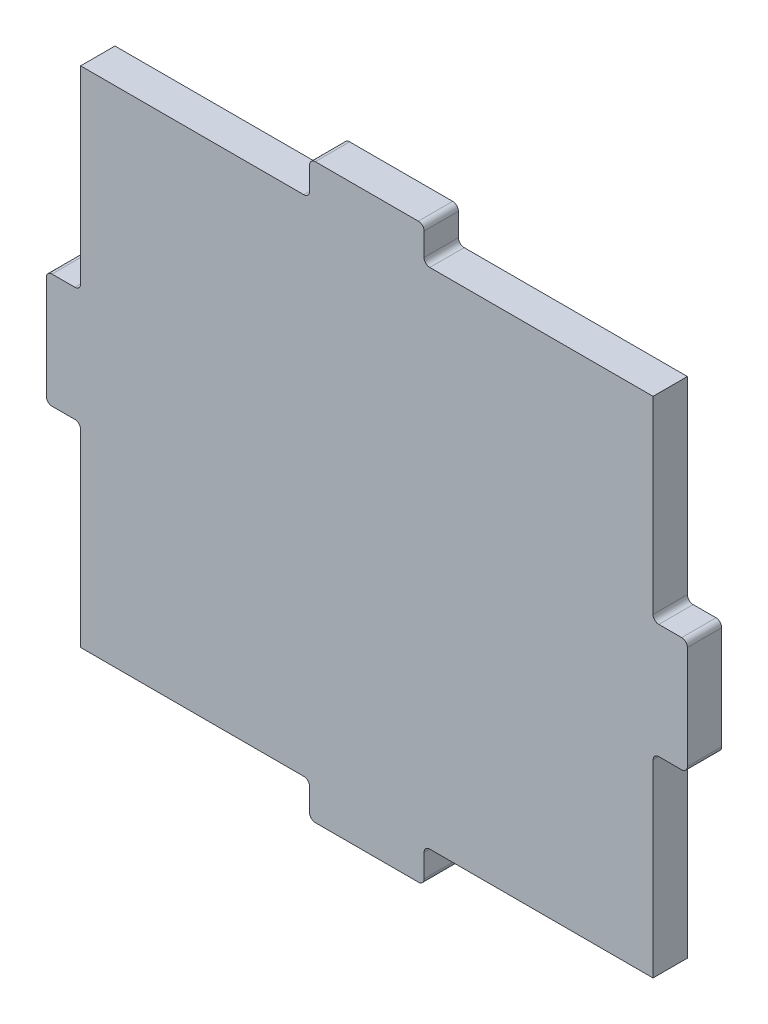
SolidWorks part; units mm, degrees
ref_plane "Front Plane" through (0, 0, 0) normal (0, 0, 1) x (1, 0, 0)
ref_plane "Top Plane" through (0, 0, 0) normal (0, 1, 0) x (1, 0, 0)
ref_plane "Right Plane" through (0, 0, 0) normal (1, 0, 0) x (0, 0, -1)
sketch "Sketch1" plane through (0, 0, 0) normal (0, 0, 1) x (1, 0, 0)
  line L0 (50, 10) -> (56, 10)
  line L1 (-50, 44) -> (-10, 44)
  line L2 (-50, 44) -> (-50, 10)
  line L3 (-50, -44) -> (-10, -44)
  line L4 (50, 44) -> (50, 10)
  line L5 (-50, 44) -> (50, -44) construction
  line L6 (-50, -44) -> (50, 44) construction
  line L7 (56, 10) -> (56, -10)
  line L8 (56, -10) -> (50, -10)
  line L9 (0, 0) -> (0, 22.8535) construction
  line L10 (-56, -10) -> (-50, -10)
  line L11 (-56, 10) -> (-56, -10)
  line L12 (-50, 10) -> (-56, 10)
  line L13 (-10, -44) -> (-10, -50)
  line L14 (-10, -50) -> (10, -50)
  line L15 (10, -50) -> (10, -44)
  line L16 (0, 0) -> (21.2881, 0) construction
  line L17 (10, 50) -> (10, 44)
  line L18 (-10, 50) -> (10, 50)
  line L19 (-10, 44) -> (-10, 50)
  line L20 (-50, -10) -> (-50, -44)
  line L21 (10, 44) -> (50, 44)
  line L22 (10, -44) -> (50, -44)
  line L23 (50, -10) -> (50, -44)
  point P0 (0, 0)
  point P8 (56, 0)
  point P11 (-56, 0)
  point P20 (0, -50)
  dimension "D1" = 88
  dimension "D2" = 100
  dimension "D3" = 6
  dimension "D4" = 20
  dimension "D5" = 6
  dimension "D6" = 20
extrude "Boss-Extrude1" add sketch "Sketch1" along normal blind 6
fillet "Fillet1" radius 1 16 edges at (-10, -50, 3) (-10, -44, 3) (10, -50, 3) (10, -44, 3) (56, -10, 3) (50, -10, 3) (56, 10, 3) (50, 10, 3) (10, 44, 3) (10, 50, 3) (-50, -10, 3) (-56, -10, 3) (-56, 10, 3) (-50, 10, 3) (-10, 50, 3) (-10, 44, 3)
